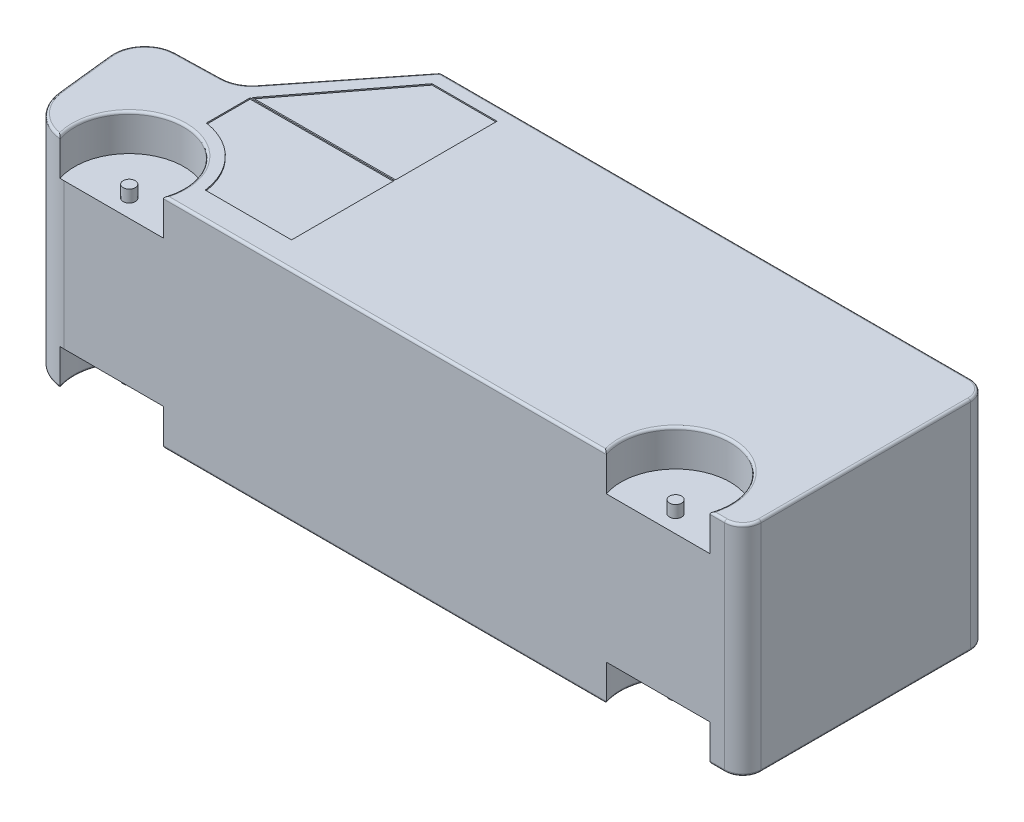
SolidWorks part; units mm, degrees
ref_plane "Plan de face" through (0, 0, 0) normal (0, 0, 1) x (1, 0, 0)
ref_plane "Plan de dessus" through (0, 0, 0) normal (0, 1, 0) x (1, 0, 0)
ref_plane "Plan de droite" through (0, 0, 0) normal (1, 0, 0) x (0, 0, -1)
sketch "Esquisse1" plane through (0, 0, 0) normal (0, 1, 0) x (1, 0, 0)
  line L0 (14.5013, 0) -> (4364.5013, 0)
  line L1 (-9.0082, -11.364) -> (-667.2124, -841.6974)
  line L2 (-864.4346, -940.1035) -> (-1233.5691, -949.3737)
  line L3 (-1485.4987, -1237.5759) -> (-1434.4709, -1703.8615)
  line L4 (-1076.3323, -2024.9455) -> (4364.5013, -2024.9455)
  line L5 (4514.5013, -150) -> (4514.5013, -1874.9455)
  arc A0 (-9.0082, -11.364) -> (14.5013, 0) centre (14.5013, -30) cw
  arc A1 (-1434.4709, -1703.8615) -> (-1076.3323, -2024.9455) centre (-1076.3323, -1664.6687) ccw
  arc A2 (-667.2124, -841.6974) -> (-864.4346, -940.1035) centre (-870.962, -680.1854) cw
  arc A3 (-1485.4987, -1237.5759) -> (-1233.5691, -949.3737) centre (-1227.0417, -1209.2917) cw
  arc A4 (4514.5013, -1874.9455) -> (4364.5013, -2024.9455) centre (4364.5013, -1874.9455) cw
  arc A5 (4364.5013, 0) -> (4514.5013, -150) centre (4364.5013, -150) cw
  point P5 (0, 0)
  dimension "D3" = 6000
  dimension "D4" = 260
  dimension "D1" = 30
  dimension "D5" = 260
  dimension "D7" = 150
  dimension "D8" = 150
  dimension "D2" = 2024.9455
  dimension "D6" = 1500
extrude "Boss.-Extru.1" add sketch "Esquisse1" along normal blind 900
sketch "Esquisse2" plane through (0, 0, 0) normal (0, 0, -1) x (-1, 0, 0)
  line L0 (-4364.5013, 0) -> (-14.5013, 0) construction
  line L1 (-14.5013, 900) -> (-14.5013, 0) construction
  line L3 (-1014.5013, 1157.2123) -> (-1014.5013, 0) construction
  line L5 (-1034.5013, 10) -> (-994.5013, 10)
  line L6 (-1034.5013, 10) -> (-1034.5013, -10)
  line L7 (-1034.5013, -10) -> (-994.5013, -10)
  line L8 (-994.5013, 10) -> (-994.5013, -10)
  line L9 (-1034.5013, 10) -> (-994.5013, -10) construction
  line L10 (-1034.5013, -10) -> (-994.5013, 10) construction
  point P8 (-1014.5013, 0)
  dimension "D1" = 40
  dimension "D2" = 20
  dimension "D3" = 1000
extrude "Enlèv. mat.-Extru.1" cut sketch "Esquisse2" against normal blind 30
sketch "Esquisse3" plane through (0, 0, 0) normal (0, 0, -1) x (-1, 0, 0)
  line L0 (-994.5013, 0) -> (-14.5013, 0) construction
  line L1 (-14.5013, 900) -> (-14.5013, 0) construction
  circle A1 centre (-264.5013, 250) radius 5
  dimension "D2" = 250
  dimension "D1" = 10
  dimension "D3" = 250
extrude "Enlèv. mat.-Extru.2" cut sketch "Esquisse3" against normal blind 10
sketch "Esquisse4" plane through (0, 900, 0) normal (0, 1, 0) x (1, 0, 0)
  circle A0 centre (-683.7979, -1880.7936) radius 450
  circle A1 centre (3816.2021, -1880.7936) radius 450
  circle A2 centre (-683.7979, -1880.7936) radius 50
  circle A3 centre (3816.2021, -1880.7936) radius 50
  dimension "D1" = 900
  dimension "D4" = 100
  dimension "D5" = 100
  dimension "D3" = 4500
  dimension "D2" = 2
extrude "Enlèv. mat.-Extru.3" cut sketch "Esquisse4" against normal blind 300
fillet "Congé3" radius 20 15 edges at (1566.2021, 900, 2024.9455) (-682.9346, 900, 1430.7945) (-1329.3423, 900, 1921.1551) (-1459.9848, 900, 1470.7187) (-1422.7949, 900, 1038.1757) (-1049.0018, 900, 944.7386) (-754.88, 900, 912.8331) (-338.1103, 900, 426.5307) (1.4453, 900, 2.99) (2189.5013, 900, 0) (4514.5013, 900, 1012.4727) (4303.495, 900, 2024.9455) (3816.2021, 900, 1430.7936) (4470.5674, 900, 43.934) (4470.5674, 900, 1981.0115)
sketch "Esquisse6" plane through (0, 0, 0) normal (-0.7837, 0, -0.6212) x (-0.6212, 0, 0.7837)
  line L0 (1113.72, 0) -> (-1113.72, 0) construction
  line L2 (34.5013, 850) -> (1039.0703, 850)
  line L3 (34.5013, 850) -> (34.5013, -850)
  line L4 (34.5013, -850) -> (1039.0703, -850)
  line L5 (1039.0703, 850) -> (1039.0703, -850)
  line L6 (34.5013, 850) -> (1039.0703, -850) construction
  line L7 (34.5013, -850) -> (1039.0703, 850) construction
  line L8 (14.5013, 880) -> (14.5013, 0) construction
  line L9 (1074.0703, 880) -> (14.5013, 880) construction
  line L10 (1074.0703, 880) -> (1074.0703, 0) construction
  point P4 (536.7858, 0)
  dimension "D1" = 20
  dimension "D2" = 30
  dimension "D3" = 35
extrude "Enlèv. mat.-Extru.4" cut sketch "Esquisse6" against normal blind 5
sketch "Esquisse7" plane through (0, 900, 0) normal (0, 1, 0) x (1, 0, 0)
  line L0 (46.914, -117.2864) -> (-594.4078, -956.349)
  line L1 (-602.0679, -1326.8368) -> (-602.0679, -966.3709)
  line L2 (46.914, -117.2864) -> (582.3239, -117.2864)
  line L3 (582.3239, -962.9869) -> (582.3239, -1810.0473)
  line L4 (582.3239, -1810.0473) -> (-128.3315, -1810.0473)
  line L5 (41.9708, -107.2864) -> (-612.0679, -962.9869)
  line L6 (-612.0679, -1335.538) -> (-612.0679, -962.9869)
  line L7 (592.3239, -1820.0473) -> (-137.2096, -1820.0473)
  line L8 (592.3239, -107.2864) -> (592.3239, -1820.0473)
  line L9 (41.9708, -107.2864) -> (592.3239, -107.2864)
  line L10 (-602.0679, -966.3709) -> (582.3239, -962.9869)
  line L11 (-594.4078, -956.349) -> (582.2954, -952.9869)
  line L12 (582.3239, -117.2864) -> (582.2954, -952.9869)
  line L13 (-602.0964, -956.3709) -> (582.2954, -952.9869) construction
  line L14 (46.914, -117.2864) -> (-602.0679, -966.3709) construction
  line L15 (582.3239, -117.2864) -> (582.3239, -1810.0473) construction
  line L19 (-217.569, -1994.9455) -> (3349.9732, -1994.9455)
  line L20 (4282.431, -1994.9455) -> (4364.5013, -1994.9455)
  line L21 (4484.5013, -1874.9455) -> (4484.5013, -150)
  line L22 (4364.5013, -30) -> (14.5013, -30)
  line L23 (14.5013, -30) -> (-643.7029, -860.3334)
  line L24 (-863.6814, -970.094) -> (-1232.8159, -979.3642)
  line L25 (-1455.6767, -1234.3123) -> (-1404.6489, -1700.5979)
  line L26 (-217.569, -1994.9455) -> (3349.9732, -1994.9455)
  line L27 (4282.431, -1994.9455) -> (4364.5013, -1994.9455)
  line L28 (4484.5013, -1874.9455) -> (4484.5013, -150)
  line L29 (4364.5013, -30) -> (14.5013, -30)
  line L30 (14.5013, -30) -> (-643.7029, -860.3334)
  line L31 (-863.6814, -970.094) -> (-1232.8159, -979.3642)
  line L32 (-1455.6767, -1234.3123) -> (-1404.6489, -1700.5979)
  arc A0 (-128.3315, -1810.0473) -> (-602.0679, -1326.8368) centre (-683.7979, -1880.7936) ccw
  arc A1 (-137.2096, -1820.0473) -> (-612.0679, -1335.538) centre (-683.7979, -1880.7936) ccw
  arc A19 (-1404.6489, -1700.5979) -> (-1152.0954, -1986.1383) centre (-1076.3323, -1664.6687) ccw
  arc A20 (-217.569, -1994.9455) -> (-1152.0954, -1986.1383) centre (-683.7979, -1880.7936) ccw
  arc A21 (4282.431, -1994.9455) -> (3349.9732, -1994.9455) centre (3816.2021, -1880.7936) ccw
  arc A22 (4364.5013, -1994.9455) -> (4484.5013, -1874.9455) centre (4364.5013, -1874.9455) ccw
  arc A23 (4484.5013, -150) -> (4364.5013, -30) centre (4364.5013, -150) ccw
  arc A24 (-863.6814, -970.094) -> (-643.7029, -860.3334) centre (-870.962, -680.1854) ccw
  arc A25 (-1232.8159, -979.3642) -> (-1455.6767, -1234.3123) centre (-1227.0417, -1209.2917) ccw
  arc A26 (-1404.6489, -1700.5979) -> (-1152.0954, -1986.1383) centre (-1076.3323, -1664.6687) ccw
  arc A27 (-217.569, -1994.9455) -> (-1152.0954, -1986.1383) centre (-683.7979, -1880.7936) ccw
  arc A28 (4282.431, -1994.9455) -> (3349.9732, -1994.9455) centre (3816.2021, -1880.7936) ccw
  arc A29 (4364.5013, -1994.9455) -> (4484.5013, -1874.9455) centre (4364.5013, -1874.9455) ccw
  arc A30 (4484.5013, -150) -> (4364.5013, -30) centre (4364.5013, -150) ccw
  arc A31 (-863.6814, -970.094) -> (-643.7029, -860.3334) centre (-870.962, -680.1854) ccw
  arc A32 (-1232.8159, -979.3642) -> (-1455.6767, -1234.3123) centre (-1227.0417, -1209.2917) ccw
  dimension "D1" = 10
  dimension "D3" = 10
  dimension "D2" = 10
extrude "Enlèv. mat.-Extru.5" cut sketch "Esquisse7" against normal blind 10 contours L12 L2 L0 L11 | A0 L4 L3 L10 L1
sketch "Esquisse8" plane through (0, 900, 0) normal (0, 1, 0) x (1, 0, 0)
  circle A0 centre (-683.7979, -1880.7936) radius 75
  circle A1 centre (3816.2021, -1880.7936) radius 75
  dimension "D1" = 2
  dimension "D2" = 150
extrude "Enlèv. mat.-Extru.6" cut sketch "Esquisse8" against normal blind 200
mirror "Symétrie1" about plane through (14.5013, 0, 30) normal (0, -1, 0)
